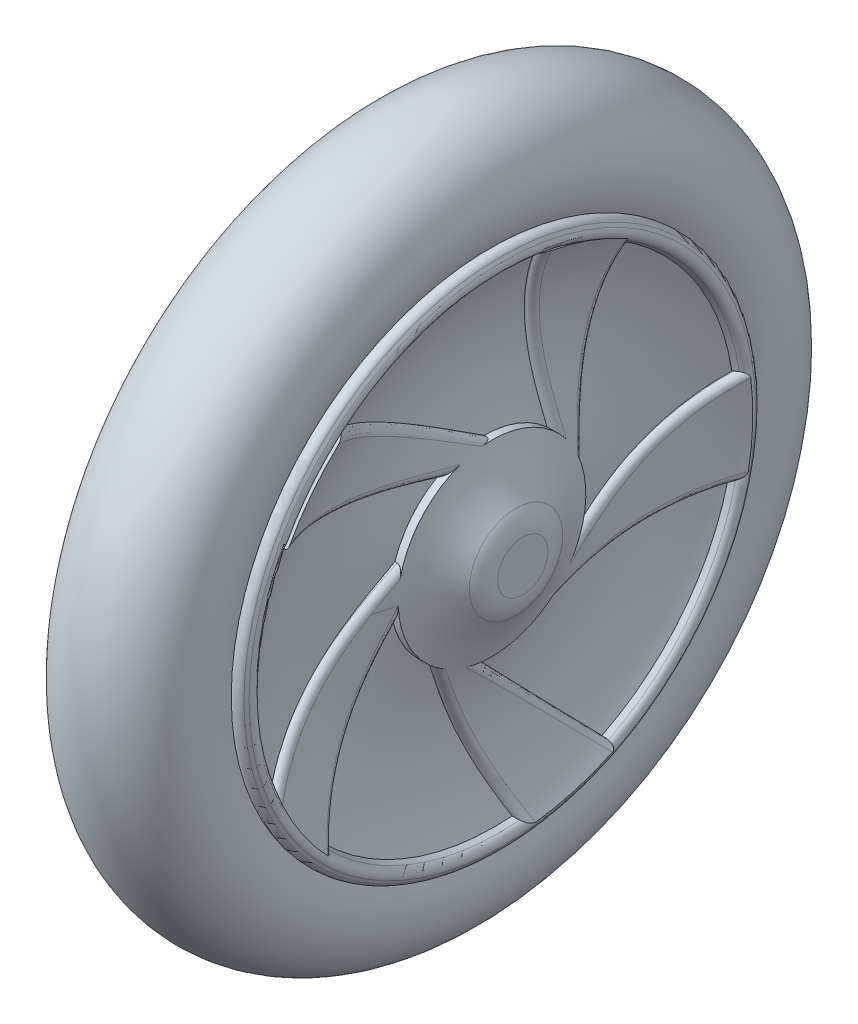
SolidWorks part; units mm, degrees
ref_plane "Front Plane" through (0, 0, 0) normal (0, 0, 1) x (1, 0, 0)
ref_plane "Top Plane" through (0, 0, 0) normal (0, 1, 0) x (1, 0, 0)
ref_plane "Right Plane" through (0, 0, 0) normal (1, 0, 0) x (0, 0, -1)
sketch "Sketch1" plane through (0, 0, 0) normal (0, 0, 1) x (1, 0, 0)
  line L0 (0, 70) -> (0, 0) construction
  line L1 (-18.0278, 70) -> (-20.6032, 65.7143)
  line L2 (18.0278, 70) -> (20.6032, 65.7143)
  line L3 (-55.4619, 0) -> (107.2607, 0) construction
  arc A0 (-18.0278, 70) -> (18.0278, 70) centre (0, 100) ccw
  arc A1 (-20.6032, 65.7143) -> (20.6032, 65.7143) centre (0, 100) ccw
  dimension "D1" = 35
  dimension "D2" = 70
  dimension "D3" = 30
  dimension "D4" = 5
revolve "Revolve1" add sketch "Sketch1" angle 360 about L3
fillet "Fillet1" radius 2 4 edges at (-20.6032, 0, 65.7143) (20.6032, 0, 65.7143) (18.0278, 0, 70) (-18.0278, 0, 70)
sketch "Sketch2" plane through (0, 0, 0) normal (0, 1, 0) x (1, 0, 0)
  line L0 (-41.3094, 0) -> (46.6856, 0) construction
  arc A0 (16.3798, -69.0694) -> (-16.3798, -69.0694) centre (0, -100) ccw construction
  arc A1 (16.3798, -69.0694) -> (-16.3798, -69.0694) centre (0, -100) ccw
  arc A2 (-16.3798, -69.0694) -> (16.3798, -69.0694) centre (0, -76.5328) ccw
  dimension "D1" = 18
revolve "Revolve2" add sketch "Sketch2" angle 360 about L0
sketch "Sketch5" plane through (0, 0, 0) normal (0, 0, 1) x (1, 0, 0)
  line L0 (-36.1547, 0) -> (46.0744, 0) construction
  line L1 (-25, 10) -> (-25, 0)
  line L2 (0, 81.598) -> (0, 0) construction
  line L3 (25, 10) -> (25, 0)
  line L4 (-25, 0) -> (25, 0)
  arc A0 (-20.6032, 65.7143) -> (20.6032, 65.7143) centre (0, 100) ccw construction
  arc A1 (-20.6032, 65.7143) -> (20.6032, 65.7143) centre (0, 100) ccw
  arc A2 (-20.6032, 65.7143) -> (-25, 10) centre (-64.1357, 41.1191) cw
  arc A3 (20.6032, 65.7143) -> (25, 10) centre (64.1357, 41.1191) ccw
  dimension "D1" = 50
  dimension "D2" = 10
  dimension "D3" = 25
revolve "Revolve3" add sketch "Sketch5" angle 360 about L4
sketch "Sketch3" plane through (0, 0, 0) normal (1, 0, 0) x (0, 0, -1)
  line L0 (0, 44.7645) -> (0, -39.176) construction
  line L1 (0, 25) -> (-42.9075, 49.7726)
  line L2 (0, 25) -> (21.8344, 25) construction
  line L3 (0, 0) -> (-12.5, 21.6506) construction
  line L4 (-12.5, 21.6506) -> (-58.5812, 29.776)
  line L5 (-24.9536, 21.6506) -> (-4.7025, 21.6506) construction
  line L6 (23.7764, 7.7254) -> (34.0775, 56.188)
  line L7 (16.7283, 18.5786) -> (10.2161, 64.9153)
  line L8 (14.6946, -20.2254) -> (63.9685, -15.0465)
  line L9 (22.8386, -10.1684) -> (64.8951, 10.3439)
  line L10 (-14.6946, -20.2254) -> (5.4573, -65.4873)
  line L11 (-2.6132, -24.863) -> (29.8913, -58.5225)
  line L12 (-23.7764, 7.7254) -> (-60.5957, -25.4268)
  line L13 (-24.4537, -5.1978) -> (-46.4212, -46.5127)
  arc A0 (16.7283, 18.5786) -> (0, 25) centre (0, 0) ccw
  arc A3 (10.2161, 64.9153) -> (-42.9075, 49.7726) centre (0, 0) ccw
  arc A8 (-12.5, 21.6506) -> (-23.7764, 7.7254) centre (0, 0) ccw
  arc A9 (-24.4537, -5.1978) -> (-14.6946, -20.2254) centre (0, 0) ccw
  arc A10 (-2.6132, -24.863) -> (14.6946, -20.2254) centre (0, 0) ccw
  arc A11 (22.8386, -10.1684) -> (23.7764, 7.7254) centre (0, 0) ccw
  circle A12 centre (0, 0) radius 65.7143 construction
  arc A13 (-58.5812, 29.776) -> (-60.5957, -25.4268) centre (0, 0) ccw
  arc A14 (64.8951, 10.3439) -> (34.0775, 56.188) centre (0, 0) ccw
  arc A15 (29.8913, -58.5225) -> (63.9685, -15.0465) centre (0, 0) ccw
  arc A16 (-46.4212, -46.5127) -> (5.4573, -65.4873) centre (0, 0) ccw
  dimension "D1" = 50
  dimension "D2" = 30
  dimension "D3" = 30
  dimension "D4" = 10
  dimension "D5" = 5
extrude "Cut-Extrude1" cut sketch "Sketch3" against normal through all both and the other way through all
fillet "Fillet4" radius 10 2 edges at (25, 0, 10) (-25, 0, 10)
fillet "Fillet6" radius 2 20 edges at (14.8966, -31.6074, 38.4959) (14.2094, -43.6241, 4.2769) (-14.9449, -50.0586, 1.4121) (-14.3751, -43.3943, -15.2822) (14.8966, -46.379, -18.1645) (14.2094, -17.5481, -40.1674) (-14.9449, -16.8119, -47.1721) (-14.3751, 1.1247, -45.993) (14.8966, 2.9436, -49.7222) (14.2094, 32.7788, -29.1017) (-14.9449, 39.6682, -30.5661) (-14.3751, 44.0895, -13.1429) (14.8966, 48.1982, -12.5655) (14.2094, 37.8065, 22.1816) (-14.9449, 41.3282, 28.2813) (-14.3751, 26.1241, 37.8703) (14.8966, 26.8446, 41.9563) (14.2094, -9.413, 42.8106) (-14.9449, -14.126, 48.0449) (-14.3751, -27.9439, 36.548)
sketch "Sketch6" plane through (0, 0, 0) normal (0, 0, 1) x (1, 0, 0)
  line L0 (23, 0) -> (23, 9.3094)
  line L1 (-23, 9.3094) -> (-23, 0)
  line L2 (-41.8134, 0) -> (49.3655, 0) construction
  line L3 (-25, 10) -> (-25, 0)
  line L4 (-25, 0) -> (25, 0)
  line L5 (25, 0) -> (25, 10)
  line L6 (-25, 10) -> (-25, 0)
  line L7 (-23, 0) -> (23, 0)
  line L8 (25, 0) -> (25, 10)
  arc A0 (17.4416, 64.0029) -> (23, 9.3094) centre (64.1357, 41.1191) ccw
  arc A1 (-23, 9.3094) -> (-17.4416, 64.0029) centre (-64.1357, 41.1191) ccw
  arc A2 (-23, 9.3094) -> (-18.8619, 66.6981) centre (-64.1357, 41.1191) ccw construction
  arc A3 (20.6032, 65.7143) -> (25, 10) centre (64.1357, 41.1191) ccw
  arc A4 (-20.6032, 65.7143) -> (20.6032, 65.7143) centre (0, 100) ccw
  arc A5 (-25, 10) -> (-20.6032, 65.7143) centre (-64.1357, 41.1191) ccw
  arc A7 (-17.4416, 64.0029) -> (17.4416, 64.0029) centre (0, 100) ccw
  arc A9 (-25, 10) -> (-20.6032, 65.7143) centre (-64.1357, 41.1191) ccw construction
  arc A10 (18.8619, 66.6981) -> (23, 9.3094) centre (64.1357, 41.1191) ccw construction
  arc A11 (20.6032, 65.7143) -> (25, 10) centre (64.1357, 41.1191) ccw construction
  dimension "D1" = 0
  dimension "D2" = 2
revolve "Revolve4" add sketch "Sketch6" angle 360 about L2
